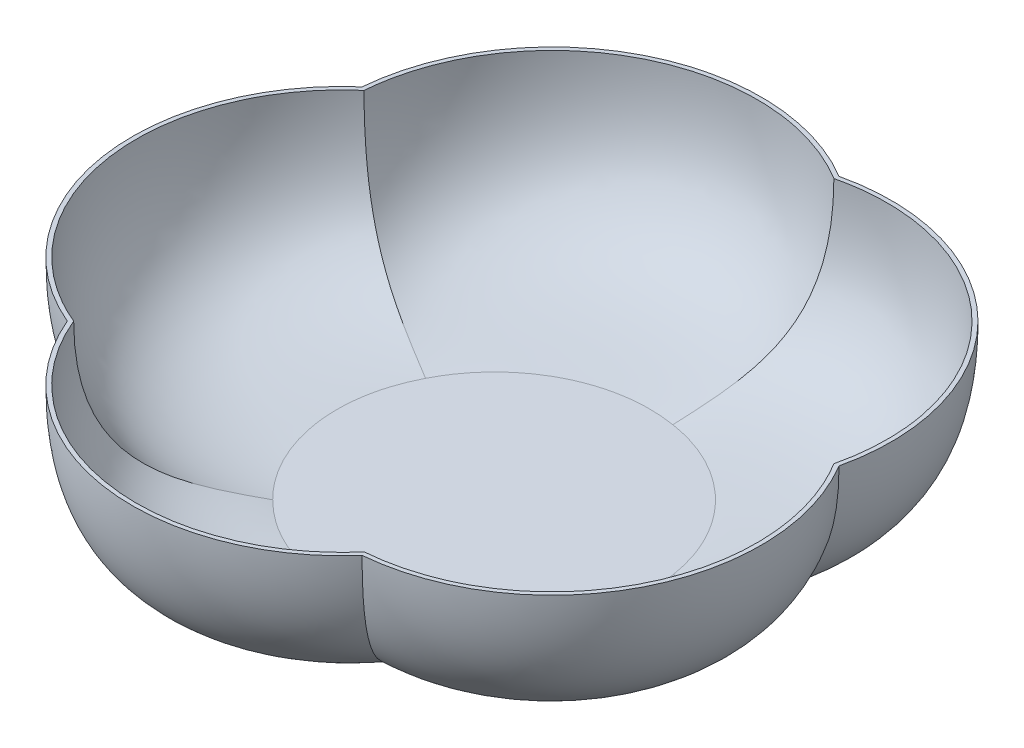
SolidWorks part; units mm, degrees
ref_plane "Front Plane" through (0, 0, 0) normal (0, 0, 1) x (1, 0, 0)
ref_plane "Top Plane" through (0, 0, 0) normal (0, 1, 0) x (1, 0, 0)
ref_plane "Right Plane" through (0, 0, 0) normal (1, 0, 0) x (0, 0, -1)
ref_plane "Plane1" through (0, 76, 0) normal (0, 1, 0) x (1, 0, 0)
sketch "Sketch1" plane through (0, 76, 0) normal (0, 1, 0) x (1, 0, 0)
  arc A1 (22.5672, 142.4839) -> (142.4839, 22.5672) centre (45.0422, 45.0422) cw
  arc A2 (142.4839, 22.5672) -> (65.4926, -128.5366) centre (56.7565, -28.9189) cw
  arc A3 (65.4926, -128.5366) -> (-102.0072, -102.0072) centre (-9.9648, -62.9151) cw
  arc A4 (-102.0072, -102.0072) -> (-128.5366, 65.4926) centre (-62.9151, -9.9648) cw
  arc A5 (-128.5366, 65.4926) -> (22.5672, 142.4839) centre (-28.9189, 56.7565) cw
  point P21 (0, 0)
  dimension "D1" = 5
sketch "Sketch2" plane through (0, 0, 0) normal (0, 1, 0) x (1, 0, 0)
  circle A0 centre (0, 0) radius 75
loft "Loft1" add profiles "Sketch1", "Sketch2"
shell "Shell1" thickness 2
